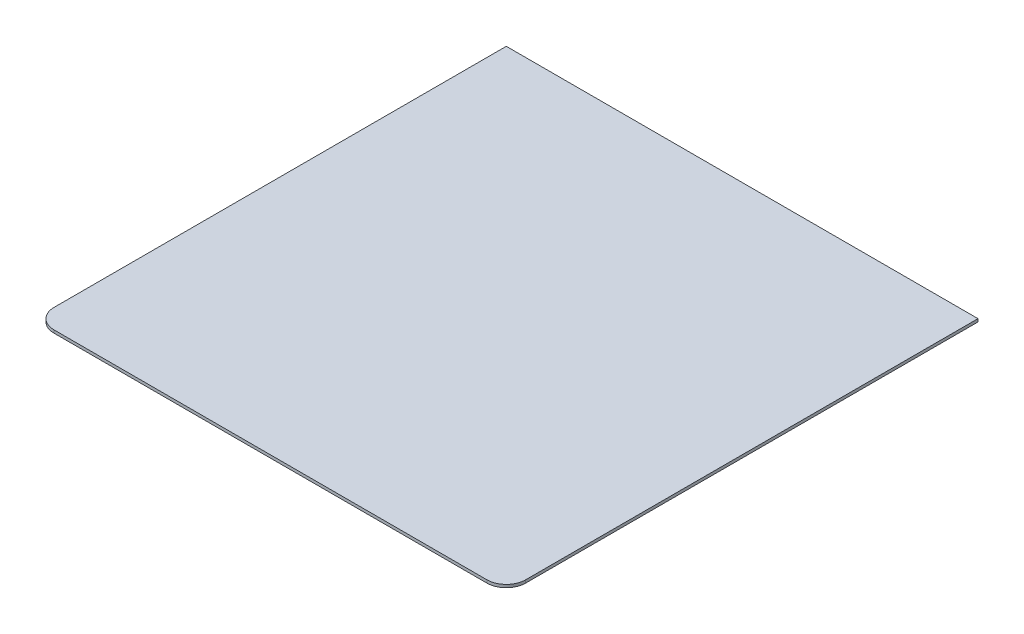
SolidWorks part; units mm, degrees
ref_plane "Alzado" through (0, 0, 0) normal (0, 0, 1) x (1, 0, 0)
ref_plane "Planta" through (0, 0, 0) normal (0, 1, 0) x (1, 0, 0)
ref_plane "Vista lateral" through (0, 0, 0) normal (1, 0, 0) x (0, 0, -1)
sketch "Sketch1" plane through (0, 0, 0) normal (0, 1, 0) x (1, 0, 0)
  line L1 (20.1795, 0) -> (469.8205, 0)
  line L2 (0, 20.1795) -> (0, 490)
  line L3 (0, 490) -> (490, 490)
  line L4 (490, 20.1795) -> (490, 490)
  arc A1 (490, 20.1795) -> (469.8205, 0) centre (469.8205, 20.1795) cw
  arc A2 (20.1795, 0) -> (0, 20.1795) centre (20.1795, 20.1795) cw
  point P1 (0, 490)
  point P2 (1.4599, 490)
  point P7 (490, 490)
  point P10 (490, 0)
  point P13 (0, 0)
  point P15 (490, 490)
  point P16 (488.4129, 490)
  dimension "D1" = 490
  dimension "D2" = 490
extrude "Boss-Extrude1" add sketch "Sketch1" along normal blind 3
